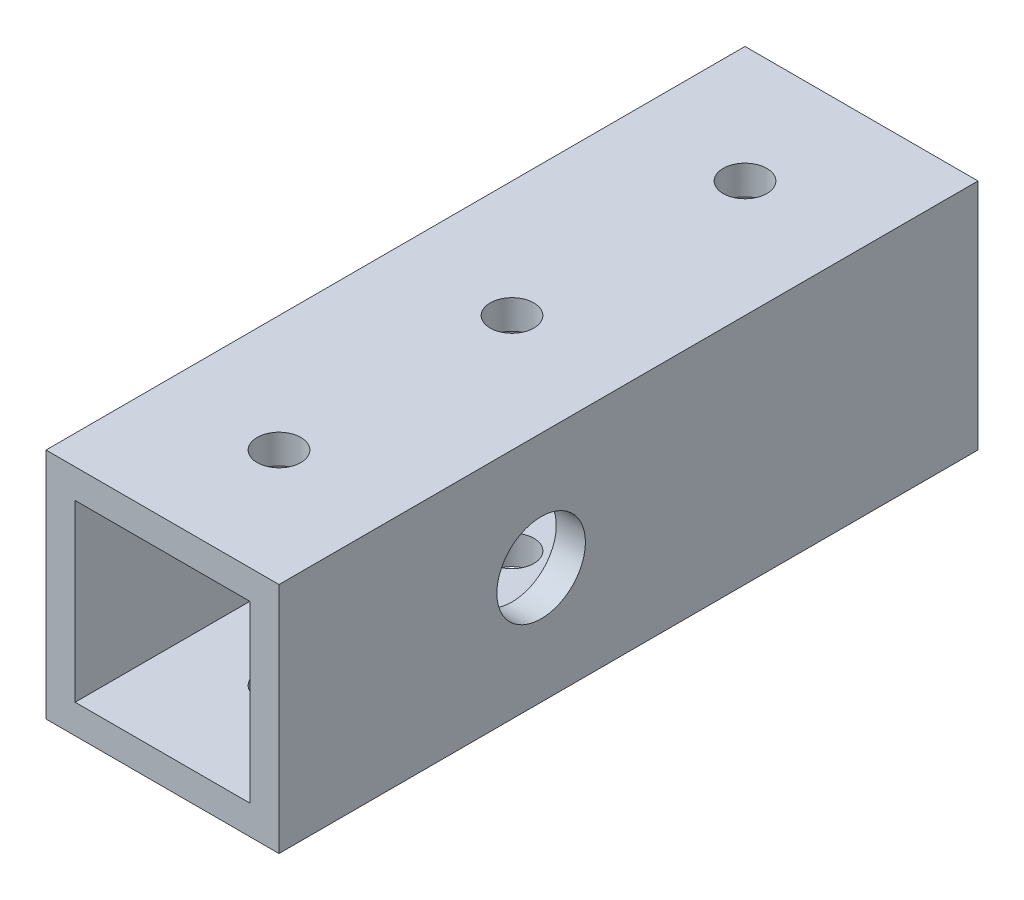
SolidWorks part; units mm, degrees
ref_plane "Front" through (0, 0, 0) normal (0, 0, 1) x (1, 0, 0)
ref_plane "Top" through (0, 0, 0) normal (0, 1, 0) x (1, 0, 0)
ref_plane "Right" through (0, 0, 0) normal (1, 0, 0) x (0, 0, -1)
sketch "Sketch1" plane through (0, 0, 0) normal (0, 0, 1) x (1, 0, 0)
  line L0 (-9.525, 9.525) -> (-9.525, -9.525)
  line L1 (-12.7, 12.7) -> (12.7, 12.7)
  line L2 (-12.7, 12.7) -> (-12.7, -12.7)
  line L3 (-12.7, -12.7) -> (12.7, -12.7)
  line L4 (12.7, 12.7) -> (12.7, -12.7)
  line L5 (-12.7, 12.7) -> (12.7, -12.7) construction
  line L6 (-12.7, -12.7) -> (12.7, 12.7) construction
  line L7 (-9.525, -9.525) -> (9.525, -9.525)
  line L8 (9.525, 9.525) -> (9.525, -9.525)
  line L9 (-9.525, 9.525) -> (9.525, 9.525)
  point P0 (0, 0)
  dimension "D1" = 25.4
  dimension "D2" = 25.4
  dimension "D3" = 3.175
extrude "Boss-Extrude1" add sketch "Sketch1" along normal mid plane 76.2 contours L0 L7 L8 L9 | L4 L3 L2 L1
sketch "Sketch2" plane through (12.7, 0, 0) normal (1, 0, 0) x (0, 0, -1)
  line L0 (-38.1, 12.7) -> (-38.1, -12.7) construction
  circle A0 centre (-9.525, 0) radius 4.826
  point P6 (-38.1, 0)
  dimension "D1" = 9.652
  dimension "D2" = 28.575
extrude "Cut-Extrude1" cut sketch "Sketch2" against normal blind 11.43
sketch "Sketch3" plane through (0, -12.7, 0) normal (0, -1, 0) x (1, 0, 0)
  line L0 (0, 43.3506) -> (0, -45.6053) construction
  line L1 (-12.7, 38.1) -> (12.7, 38.1) construction
  circle A0 centre (0, 25.4) radius 2.3813
  dimension "D2" = 4.7625
  dimension "D1" = 12.7
extrude "Cut-Extrude2" cut sketch "Sketch3" against normal through all
pattern_linear "LPattern1" count 3 spacing 25.4 along (0, 0, -1) of "Cut-Extrude2"
sketch "Sketch4" plane through (-9.525, 0, 0) normal (1, 0, 0) x (0, 0, -1)
  circle A0 centre (-9.525, 0) radius 4.826 construction
  circle A1 centre (-9.525, 0) radius 4.826 construction
  circle A2 centre (-9.525, 0) radius 3.556
  dimension "D1" = 7.112
extrude "Cut-Extrude3" cut sketch "Sketch4" against normal blind 60.452 and the other way blind 6.858 contours A2
